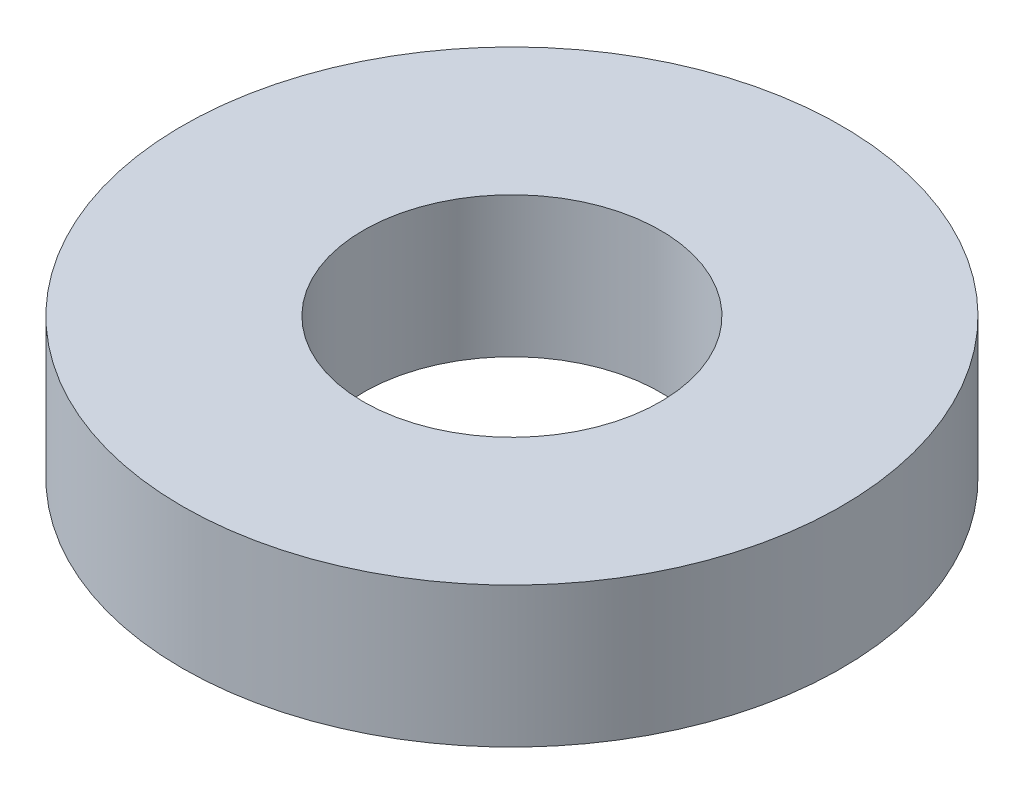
SolidWorks part; units mm, degrees
ref_plane "Front Plane" through (0, 0, 0) normal (0, 0, 1) x (1, 0, 0)
ref_plane "Top Plane" through (0, 0, 0) normal (0, 1, 0) x (1, 0, 0)
ref_plane "Right Plane" through (0, 0, 0) normal (1, 0, 0) x (0, 0, -1)
sketch "Sketch1" plane through (0, 0, 0) normal (0, 1, 0) x (1, 0, 0)
  circle A0 centre (0, 0) radius 6.13
  circle A1 centre (0, 0) radius 13.6
  dimension "D1" = 12.26
  dimension "D2" = 27.2
extrude "Boss-Extrude1" add sketch "Sketch1" along normal mid plane 5.79
